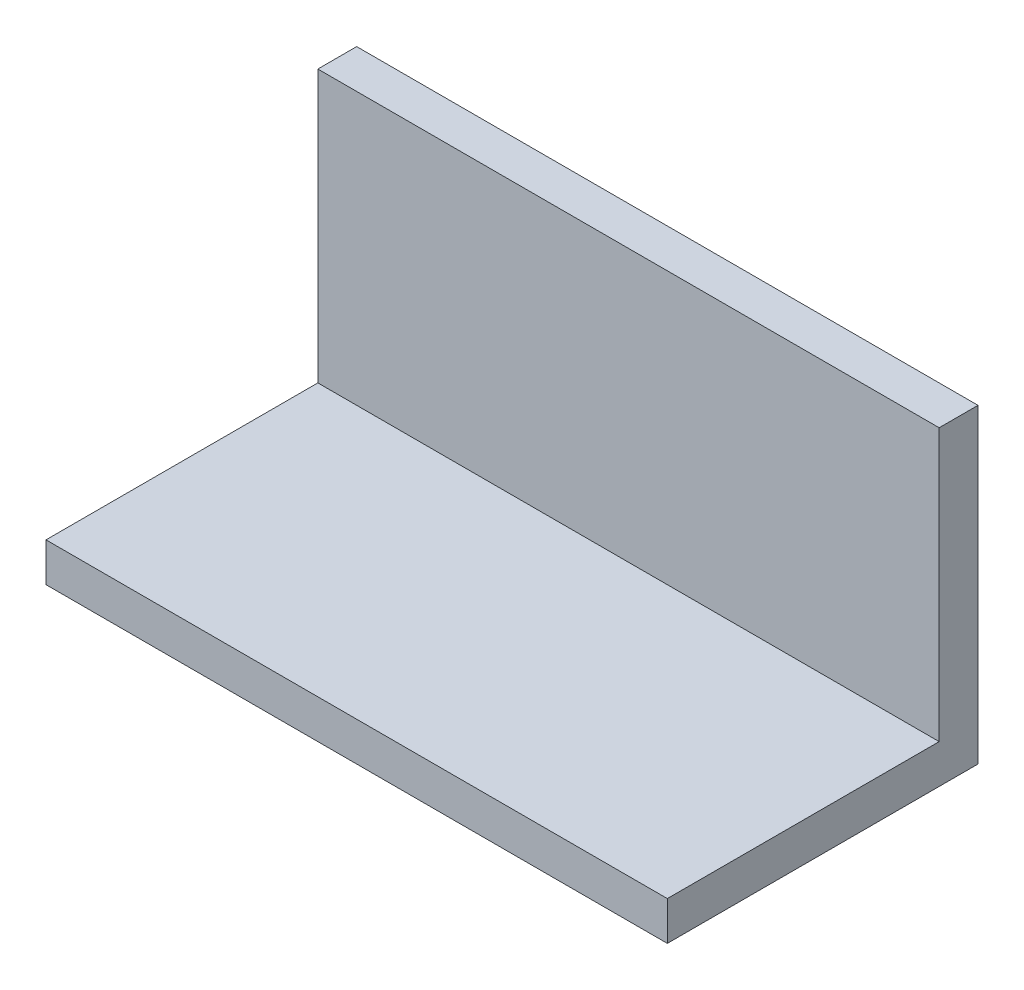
SolidWorks part; units mm, degrees
ref_plane "Front Plane" through (0, 0, 0) normal (0, 0, 1) x (1, 0, 0)
ref_plane "Top Plane" through (0, 0, 0) normal (0, 1, 0) x (1, 0, 0)
ref_plane "Right Plane" through (0, 0, 0) normal (1, 0, 0) x (0, 0, -1)
sketch "Sketch1" plane through (0, 0, 0) normal (1, 0, 0) x (0, 0, -1)
  line L3 (-12.7, -12.7) -> (12.7, -12.7)
  line L4 (-12.7, -12.7) -> (-12.7, -9.525)
  line L5 (9.525, 12.7) -> (12.7, 12.7)
  line L6 (12.7, -12.7) -> (12.7, 12.7)
  line L7 (-12.7, -12.7) -> (12.7, 12.7) construction
  line L8 (-12.7, 12.7) -> (12.7, -12.7) construction
  line L9 (9.525, -9.525) -> (9.525, 9.525)
  line L10 (-9.525, -9.525) -> (9.525, -9.525)
  line L12 (9.525, 9.525) -> (9.525, 12.7)
  line L13 (-9.525, -9.525) -> (-12.7, -9.525)
  line L14 (-12.7, -12.7) -> (-12.7, 12.7) construction
  line L15 (-9.525, -9.525) -> (-9.525, 9.525) construction
  line L16 (-12.7, 12.7) -> (12.7, 12.7) construction
  line L17 (-9.525, 9.525) -> (9.525, 9.525) construction
  point P0 (0, 0)
  dimension "D1" = 25.4
  dimension "D2" = 3.175
extrude "Boss-Extrude1" add sketch "Sketch1" along normal mid plane 50.8
